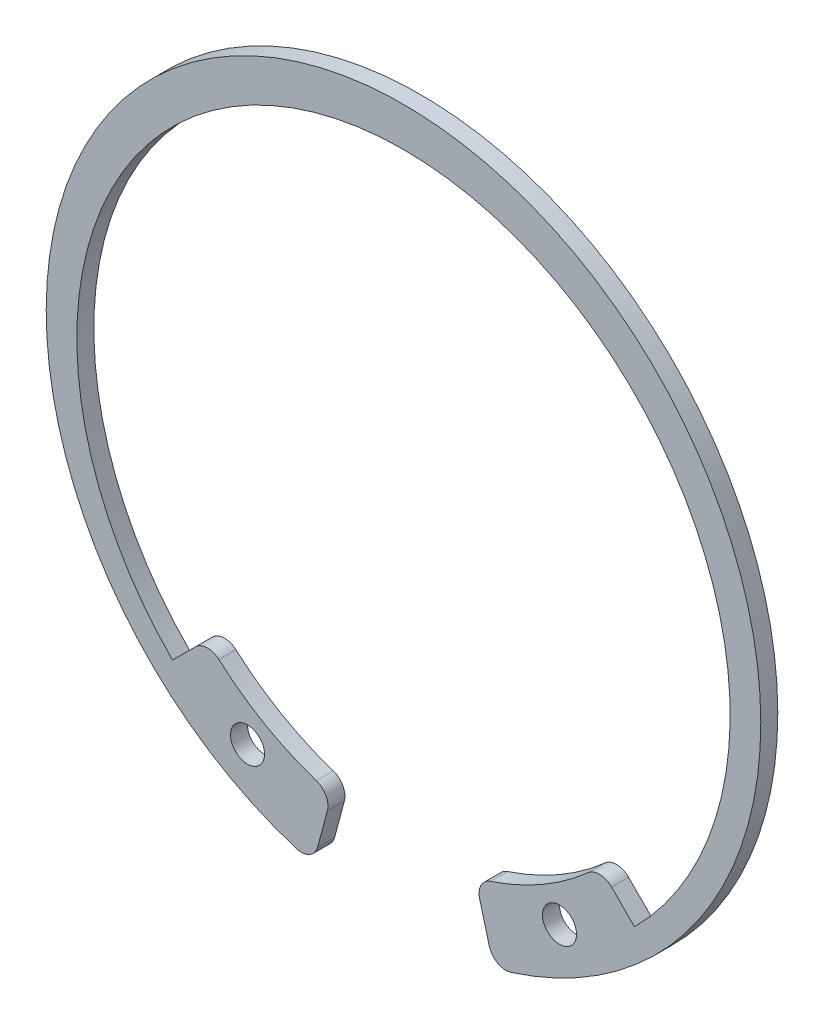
SolidWorks part; units mm, degrees
ref_plane "Plan1" through (0, 0, 0) normal (0, 0, 1) x (1, 0, 0)
ref_plane "Plan2" through (0, 0, 0) normal (0, 1, 0) x (1, 0, 0)
ref_plane "Plan3" through (0, 0, 0) normal (1, 0, 0) x (0, 0, -1)
sketch "Esquisse1" plane through (0, 0, 0) normal (0, 0, 1) x (1, 0, 0)
  line L0 (-4.9693, 18.5458) -> (2.0576, -7.6791) construction
  line L1 (0, 0) -> (0, -67.082) construction
  line L2 (5.0465, -18.8337) -> (4.4744, -16.6987)
  line L3 (0, 0) -> (7, -7) construction
  line L4 (12.2243, -12.2243) -> (13.5765, -13.5765)
  line L5 (-5.0465, -18.8337) -> (-4.4744, -16.6987)
  line L6 (-12.2243, -12.2243) -> (-13.5765, -13.5765)
  line L7 (0, 0) -> (0, 19.2) construction
  line L8 (0, 19.2) -> (0, 21.5) construction
  line L9 (-4.7604, -17.7662) -> (-13.5765, -13.5765) construction
  arc A0 (13.5765, -13.5765) -> (-13.5765, -13.5765) centre (0, 0) ccw
  arc A1 (-10.8521, -12.1846) -> (-5.1262, -15.4905) centre (0, 0) ccw
  arc A2 (6.313, -19.5286) -> (-6.313, -19.5286) centre (0, 0.5) ccw
  arc A4 (5.1262, -15.4905) -> (10.8521, -12.1846) centre (0, 0) ccw
  arc A5 (10.8521, -12.1846) -> (12.2243, -12.2243) centre (11.5172, -12.9314) cw
  arc A6 (4.4744, -16.6987) -> (5.1262, -15.4905) centre (5.4403, -16.4399) cw
  arc A7 (-4.4744, -16.6987) -> (-5.1262, -15.4905) centre (-5.4403, -16.4399) ccw
  arc A8 (-12.2243, -12.2243) -> (-10.8521, -12.1846) centre (-11.5172, -12.9314) cw
  arc A9 (-6.313, -19.5286) -> (-5.0465, -18.8337) centre (-6.0124, -18.5749) ccw
  arc A10 (6.313, -19.5286) -> (5.0465, -18.8337) centre (6.0124, -18.5749) cw
  circle A11 centre (-9.1684, -15.6713) radius 1
  circle A12 centre (9.1684, -15.6713) radius 1
  point P19 (11.5376, -11.5376)
  point P22 (4.2231, -15.7607)
  point P25 (-4.2231, -15.7607)
  point P30 (-11.5376, -11.5376)
  point P33 (-5.3101, -19.8176)
  point P36 (5.3101, -19.8176)
  dimension "D1" = 21
  dimension "D2" = 4.2
  dimension "D3" = 2.3
  dimension "D6" = 1
  dimension "D4" = 0.5
  dimension "D7" = 2
  dimension "D5" = 30
extrude "Base-Extrusion" add sketch "Esquisse1" along normal blind 1
equation "\"D5@Esquisse1\"=\"a@Esquisse1\"*2"
equation "\"D6@Esquisse1\"=\"D7@Esquisse1\"/2"
equation "\"D4@Esquisse1\" = \"D6@Esquisse1\"/2"
